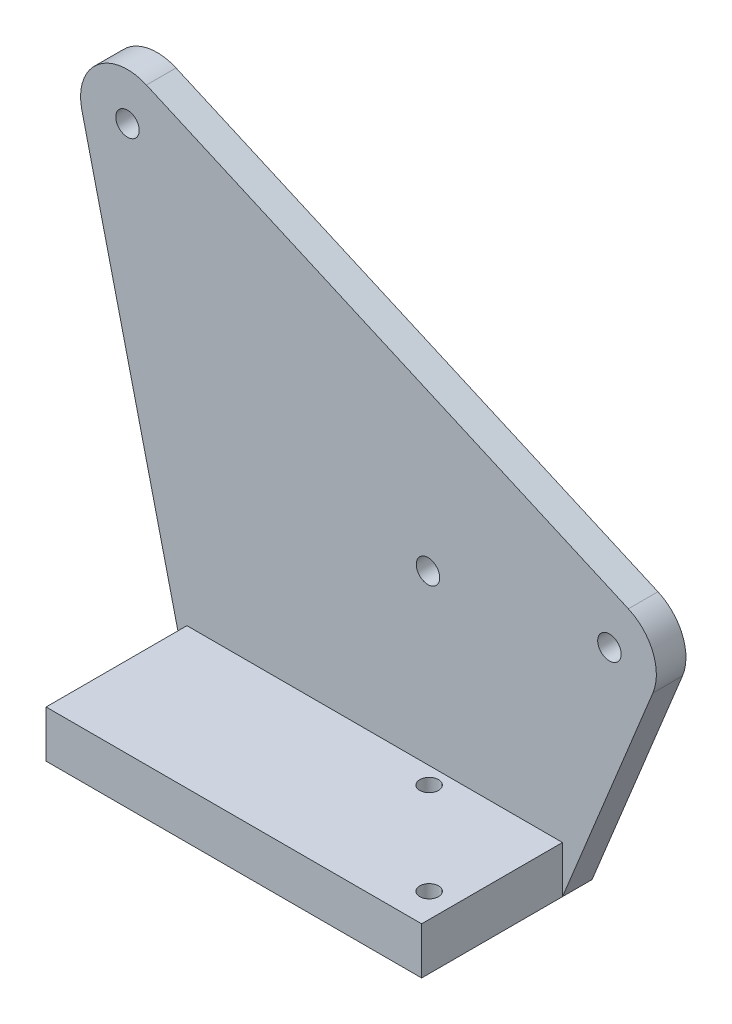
SolidWorks part; units mm, degrees
ref_plane "Front Plane" through (0, 0, 0) normal (0, 0, 1) x (1, 0, 0)
ref_plane "Top Plane" through (0, 0, 0) normal (0, 1, 0) x (1, 0, 0)
ref_plane "Right Plane" through (0, 0, 0) normal (1, 0, 0) x (0, 0, -1)
sketch "Sketch1" plane through (0, 0, 0) normal (0, 0, 1) x (1, 0, 0)
  line L0 (-130.3782, 57.531) -> (-130.3782, 0) construction
  line L1 (-130.3782, 0) -> (0, 0) construction
  line L8 (5.1271, 11.6191) -> (-125.2511, 69.1501)
  line L9 (-142.7324, 54.5875) -> (-114.3, -64.7446)
  line L10 (-114.3, -64.7446) -> (-12.7, -64.7446)
  line L11 (-12.7, -64.7446) -> (11.7589, -4.7977)
  circle A2 centre (-130.3782, 57.531) radius 3.175
  circle A4 centre (0, 0) radius 3.175
  arc A8 (-125.2511, 69.1501) -> (-142.7324, 54.5875) centre (-130.3782, 57.531) ccw
  arc A9 (11.7589, -4.7977) -> (5.1271, 11.6191) centre (0, 0) ccw
  dimension "D4" = 12.7
  dimension "D7" = 6.35
  dimension "D1" = 130.3782
  dimension "D2" = 57.531
  dimension "D3" = 64.7446
  dimension "D5" = 101.6
  dimension "D6" = 12.7
extrude "Boss-Extrude1" add sketch "Sketch1" along normal mid plane 8
sketch "Sketch2" plane through (0, 0, 4) normal (0, 0, 1) x (1, 0, 0)
  line L1 (-114.3, -64.7446) -> (-12.7, -64.7446)
  line L2 (-114.3, -64.7446) -> (-114.3, -52.0446)
  line L3 (-114.3, -52.0446) -> (-12.7, -52.0446)
  line L4 (-12.7, -64.7446) -> (-12.7, -52.0446)
  dimension "D1" = 12.7
extrude "Boss-Extrude2" add sketch "Sketch2" along normal blind 38.1
sketch "Sketch3" plane through (0, 0, 4) normal (0, 0, 1) x (1, 0, 0)
  circle A1 centre (-49.0817, -6.6489) radius 3.175
extrude "Cut-Extrude1" cut sketch "Sketch3" against normal up to surface (8 mm away)
sketch "Sketch4" plane through (0, -64.7446, 0) normal (0, -1, 0) x (1, 0, 0)
  line L0 (-12.7, 42.1) -> (-114.3, 42.1) construction
  line L1 (-12.7, 42.1) -> (-12.7, 4) construction
  circle A0 centre (-19.304, 33.464) radius 2.54
  circle A1 centre (-44.196, 8.572) radius 2.54
  dimension "D1" = 5.08
  dimension "D2" = 24.892
  dimension "D3" = 24.892
  dimension "D4" = 33.528
  dimension "D5" = 6.604
extrude "Cut-Extrude2" cut sketch "Sketch4" against normal up to surface (12.7 mm away)
